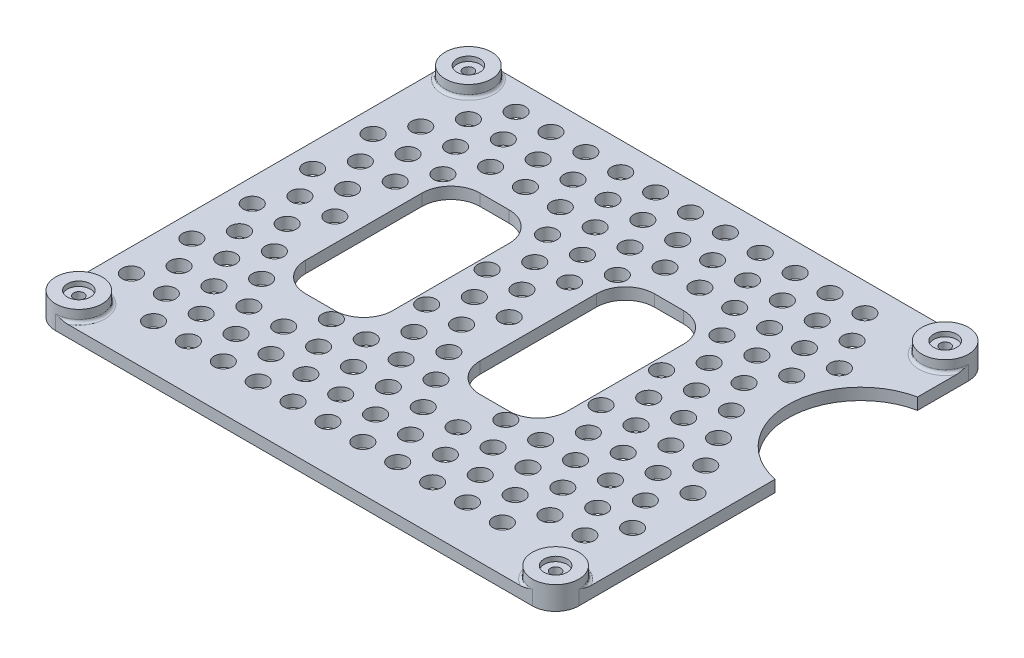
SolidWorks part; units mm, degrees
ref_plane "Front Plane" through (0, 0, 0) normal (0, 0, 1) x (1, 0, 0)
ref_plane "Top Plane" through (0, 0, 0) normal (0, 1, 0) x (1, 0, 0)
ref_plane "Right Plane" through (0, 0, 0) normal (1, 0, 0) x (0, 0, -1)
sketch "Sketch1" plane through (0, 0, 0) normal (0, 1, 0) x (1, 0, 0)
  line L1 (-45, -37.5) -> (45, -37.5)
  line L2 (-45, -37.5) -> (-45, 37.5)
  line L3 (-45, 37.5) -> (45, 37.5)
  line L4 (45, -37.5) -> (45, 37.5)
  line L5 (0, -37.5) -> (0, 37.5) construction
  dimension "D1" = 90
  dimension "D2" = 75
extrude "plate" add sketch "Sketch1" along normal blind 2
fillet "fillet.plate corners" radius 4 4 edges at (45, 1, 37.5) (45, 1, -37.5) (-45, 1, -37.5) (-45, 1, 37.5)
sketch "Sketch12" plane through (0, 2, 0) normal (0, 1, 0) x (-1, 0, 0)
  line L1 (-41, -37.5) -> (41, -37.5) construction
  line L2 (-45, 33.5) -> (-45, -33.5) construction
  arc A1 (-45, -24.7474) -> (-45, -0.2526) centre (-47.5, -12.5) ccw
  dimension "D1" = 25
  dimension "D3" = 12.5
  dimension "D2" = 10
extrude "circular cut" cut sketch "Sketch12" against normal through all and the other way through all
sketch "Sketch2" plane through (0, 2, 0) normal (0, 1, 0) x (1, 0, 0)
  line L0 (41, 37.5) -> (-41, 37.5) construction
  line L1 (-23, 17.5) -> (-18, 17.5)
  line L2 (-28, 12.5) -> (-28, -7.5)
  line L3 (-23, -12.5) -> (-18, -12.5)
  line L4 (-13, 12.5) -> (-13, -7.5)
  line L5 (45, -33.5) -> (45, 0.2526) construction
  arc A0 (-23, 17.5) -> (-28, 12.5) centre (-23, 12.5) ccw
  arc A1 (-18, 17.5) -> (-13, 12.5) centre (-18, 12.5) cw
  arc A2 (-18, -12.5) -> (-13, -7.5) centre (-18, -7.5) ccw
  arc A3 (-28, -7.5) -> (-23, -12.5) centre (-23, -7.5) ccw
  dimension "D1" = 5
  dimension "D2" = 15
  dimension "D3" = 30
  dimension "D4" = 58
  dimension "D5" = 20
extrude "rectangular cut" cut sketch "Sketch2" against normal through all
sketch "Sketch7" plane through (0, 2, 0) normal (0, 1, 0) x (1, 0, 0)
  circle A0 centre (-41, -33.5) radius 4
  circle A1 centre (-41, 33.5) radius 4
  circle A2 centre (41, 33.5) radius 4
  circle A3 centre (41, -33.5) radius 4
  arc A4 (41, -37.5) -> (45, -33.5) centre (41, -33.5) ccw construction
  arc A5 (45, 33.5) -> (41, 37.5) centre (41, 33.5) ccw construction
  arc A6 (-41, 37.5) -> (-45, 33.5) centre (-41, 33.5) ccw construction
  arc A7 (-45, -33.5) -> (-41, -37.5) centre (-41, -33.5) ccw construction
extrude "mounting bosses" add sketch "Sketch7" along normal blind 2
hole_wizard "CBORE for #0 Binding Head Machine Screw1" positions "Sketch9" profile "Sketch10" counterbore size "#0" standard "Ansi Inch"
sketch "Sketch9" plane through (0.1008, 4, -0.0125) normal (0, 1, 0) x (-1, 0, 0)
  point P5 (41.1008, -33.4875)
  point P9 (41.1008, 33.5125)
  point P12 (-40.8992, 33.5125)
  point P15 (-40.8992, -33.4875)
sketch "Sketch10" plane through (-41, 4, -33.5) normal (1, 0, 0) x (0, 0, 1)
  line L0 (0, 0) -> (0, 4)
  line L1 (0, 4) -> (0.889, 4)
  line L3 (0.889, 4) -> (0.889, 0.8128)
  line L4 (0.889, 0.8128) -> (1.985, 0.8128)
  line L5 (1.985, 0.8128) -> (1.985, 0)
  line L7 (1.985, 0) -> (0, 0)
  line L11 (0, -6.35) -> (0, 107.95) construction
  dimension "Thru Hole Dia." = 1.778
  dimension "Thru Hole Depth" = 4
  dimension "C'Bore Dia." = 3.97
  dimension "C'Bore Depth" = 0.8128
fillet "fillet.base of mb" radius 0.5 4 edges at (38.1716, 2, 30.6716) (38.1716, 2, -30.6716) (-38.1716, 2, -30.6716)
hole_wizard "1/8 (0.125) Diameter Hole1" positions "Sketch5" profile "Sketch6" hole size "1/8" standard "Ansi Inch"
sketch "Sketch5" plane through (0, 2, 0) normal (0, 1, 0) x (1, 0, 0)
  line L0 (-45, 31.4384) -> (-45, -31.4384) construction
  line L1 (38.9384, 37.5) -> (-38.9384, 37.5) construction
  point P0 (-35, 27.5)
  dimension "D1" = 10
  dimension "D2" = 10
sketch "Sketch6" plane through (-35, 2, -27.5) normal (1, 0, 0) x (0, 0, 1)
  line L0 (0, 0) -> (0, 2)
  line L1 (0, 2) -> (1.5875, 2)
  line L2 (1.5875, 2) -> (1.5875, 0)
  line L5 (1.5875, 0) -> (0, 0)
  line L11 (0, -6.35) -> (0, 107.95) construction
  dimension "Thru Hole Dia." = 3.175
  dimension "Thru Hole Depth" = 2
pattern_linear "LPattern1" count 2 spacing 30 along (1, 0, 0) of "rectangular cut"
other "Area Fill Pattern1" parameters "D1"=6, "D2"=60, "D3"=2
sketch "Sketch13" plane through (0, 2, 0) normal (0, 1, 0) x (-1, 0, 0)
  line L0 (35, -27.5) -> (2, 29.6577) construction
  line L1 (-38.9384, -37.5) -> (38.9384, -37.5) construction
  line L2 (38, -11.9115) -> (38, 19.2654) construction
  line L3 (32, -11.9115) -> (32, 19.2654) construction
  line L4 (38.9384, 37.5) -> (-38.9384, 37.5) construction
  point P14 (-22, 29.6577)
  dimension "D1" = 60
  dimension "D2" = 6
  dimension "D3" = 7.8423
